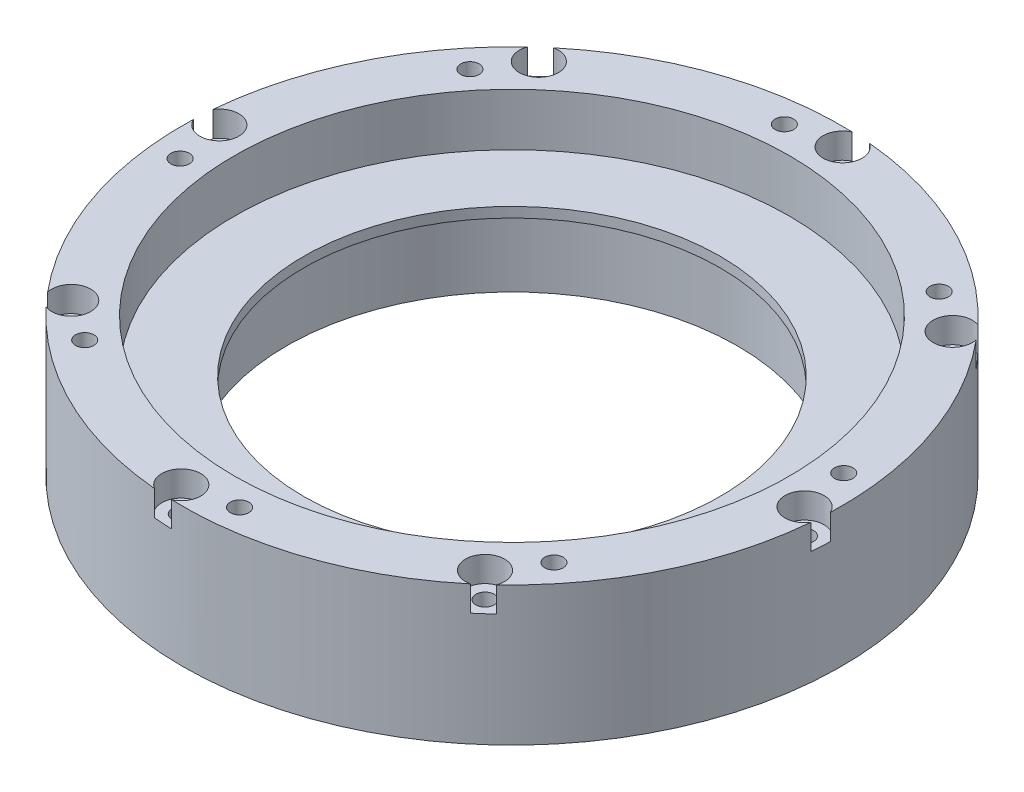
SolidWorks part; units mm, degrees
ref_plane "Front Plane" through (0, 0, 0) normal (0, 0, 1) x (1, 0, 0)
ref_plane "Top Plane" through (0, 0, 0) normal (0, 1, 0) x (1, 0, 0)
ref_plane "Right Plane" through (0, 0, 0) normal (1, 0, 0) x (0, 0, -1)
sketch "Sketch1" plane through (0, 0, 0) normal (0, 1, 0) x (1, 0, 0)
  circle A0 centre (0, 0) radius 120.65
  dimension "D1" = 241.3
extrude "Boss-Extrude1" add sketch "Sketch1" along normal blind 50.8
sketch "Sketch3" plane through (0, 50.8, 0) normal (0, 1, 0) x (1, 0, 0)
  circle A0 centre (0, 0) radius 101.6
  dimension "D1" = 203.2
extrude "Cut-Extrude1" cut sketch "Sketch3" against normal blind 19.177
sketch "Sketch4" plane through (0, 0, 0) normal (0, -1, 0) x (1, 0, 0)
  circle A0 centre (0, 0) radius 82.55
  dimension "D1" = 165.1
extrude "Cut-Extrude2" cut sketch "Sketch4" against normal blind 27.94
sketch "Sketch5" plane through (0, 31.623, 0) normal (0, 1, 0) x (1, 0, 0)
  circle A0 centre (0, 0) radius 76.2
  dimension "D1" = 152.4
extrude "Cut-Extrude3" cut sketch "Sketch5" against normal through all
hole_wizard "F (0.257) Diameter Hole1" positions "Sketch9" profile "Sketch10" hole size "F" standard "ANSI Inch"
sketch "Sketch9" plane through (0, 0, 0) normal (0, -1, 0) x (-1, 0, 0)
  point P0 (75.7462, 85.5979)
  point P3 (-6.9662, 114.0875)
  point P6 (114.0875, 6.9662)
  point P9 (85.5979, -75.7462)
  point P12 (6.9662, -114.0875)
  point P15 (-75.7462, -85.5979)
  point P18 (-114.0875, -6.9662)
  point P21 (-85.5979, 75.7462)
sketch "Sketch10" plane through (-75.7462, 0, -85.5979) normal (1, 0, 0) x (0, 0, -1)
  line L0 (0, 0) -> (0, 50.8)
  line L1 (0, 50.8) -> (3.2639, 50.8)
  line L2 (3.2639, 50.8) -> (3.2639, 0)
  line L5 (3.2639, 0) -> (0, 0)
  line L11 (0, -6.35) -> (0, 107.95) construction
  dimension "Thru Hole Dia." = 6.5278
  dimension "Thru Hole Depth" = 50.8
hole_wizard "CBORE for 1/4 Binding Head Machine Screw1" positions "Sketch11" profile "Sketch12" counterbore size "1/4" standard "ANSI Inch"
sketch "Sketch11" plane through (0, 50.8, 0) normal (0, 1, 0) x (1, 0, 0)
  point P0 (-6.9662, -114.0875)
  point P3 (75.7462, -85.5979)
  point P6 (-85.5979, -75.7462)
  point P9 (-114.0875, 6.9662)
  point P12 (-75.7462, 85.5979)
  point P15 (6.9662, 114.0875)
  point P18 (85.5979, 75.7462)
  point P21 (114.0875, -6.9662)
sketch "Sketch12" plane through (-6.9662, 50.8, 114.0875) normal (1, 0, 0) x (0, 0, 1)
  line L0 (0, 0) -> (0, 50.8)
  line L1 (0, 50.8) -> (3.3782, 50.8)
  line L3 (3.3782, 50.8) -> (3.3782, 9.271)
  line L4 (3.3782, 9.271) -> (7.1437, 9.271)
  line L5 (7.1437, 9.271) -> (7.1437, 0)
  line L7 (7.1437, 0) -> (0, 0)
  line L11 (0, -6.35) -> (0, 107.95) construction
  dimension "Thru Hole Dia." = 6.7564
  dimension "Thru Hole Depth" = 50.8
  dimension "C'Bore Dia." = 14.2875
  dimension "C'Bore Depth" = 9.271
hole_wizard "Tapped Hole for 1/4-20 Helicoil1" positions "Sketch13" profile "Sketch14" tap size "1/4-20" standard "Helicoil® Inch"
sketch "Sketch13" plane through (0, 50.8, 0) normal (0, 1, 0) x (1, 0, 0)
  point P0 (85.8905, -70.5095)
  point P3 (10.876, -110.5915)
  point P6 (-70.5095, -85.8905)
  point P9 (-110.5915, -10.876)
  point P12 (-85.8905, 70.5095)
  point P15 (-10.876, 110.5915)
  point P18 (70.5095, 85.8905)
  point P21 (110.5915, 10.876)
sketch "Sketch14" plane through (85.8905, 50.8, 70.5095) normal (1, 0, 0) x (0, 0, 1)
  line L0 (0, 0) -> (0, 19.3018)
  line L1 (0, 19.3018) -> (3.3782, 17.272)
  line L2 (3.3782, 17.272) -> (3.3782, 0)
  line L5 (3.3782, 0) -> (0, 0)
  line L10 (0, 19.3018) -> (-3.3782, 17.272) construction
  line L11 (0, -6.35) -> (0, 107.95) construction
  dimension "Tap Drill Dia." = 6.7564
  dimension "Tap Drill Depth" = 17.272
  dimension "Drill Angle" = 118
